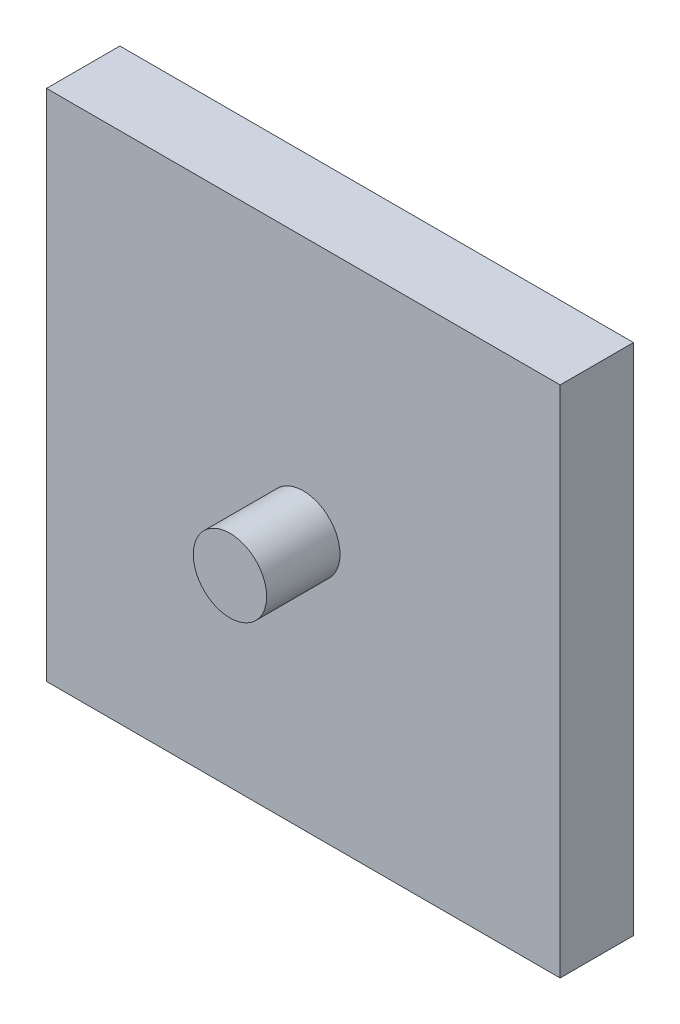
SolidWorks part; units mm, degrees
ref_plane "Płaszczyzna przednia" through (0, 0, 0) normal (0, 0, 1) x (1, 0, 0)
ref_plane "Płaszczyzna górna" through (0, 0, 0) normal (0, 1, 0) x (1, 0, 0)
ref_plane "Płaszczyzna prawa" through (0, 0, 0) normal (1, 0, 0) x (0, 0, -1)
sketch "Szkic1" plane through (0, 0, 0) normal (0, 0, 1) x (1, 0, 0)
  line L1 (35, -35) -> (-35, -35)
  line L2 (35, -35) -> (35, 35)
  line L3 (35, 35) -> (-35, 35)
  line L4 (-35, -35) -> (-35, 35)
  line L5 (35, -35) -> (-35, 35) construction
  line L6 (35, 35) -> (-35, -35) construction
  point P0 (0, 0)
  dimension "D1" = 70
extrude "Dodanie-wyciągnięcie1" add sketch "Szkic1" along normal blind 10
sketch "Szkic2" plane through (0, 0, 10) normal (0, 0, 1) x (1, 0, 0)
  circle A0 centre (0, 0) radius 5
  dimension "D1" = 10
extrude "Dodanie-wyciągnięcie2" add sketch "Szkic2" along normal blind 10
